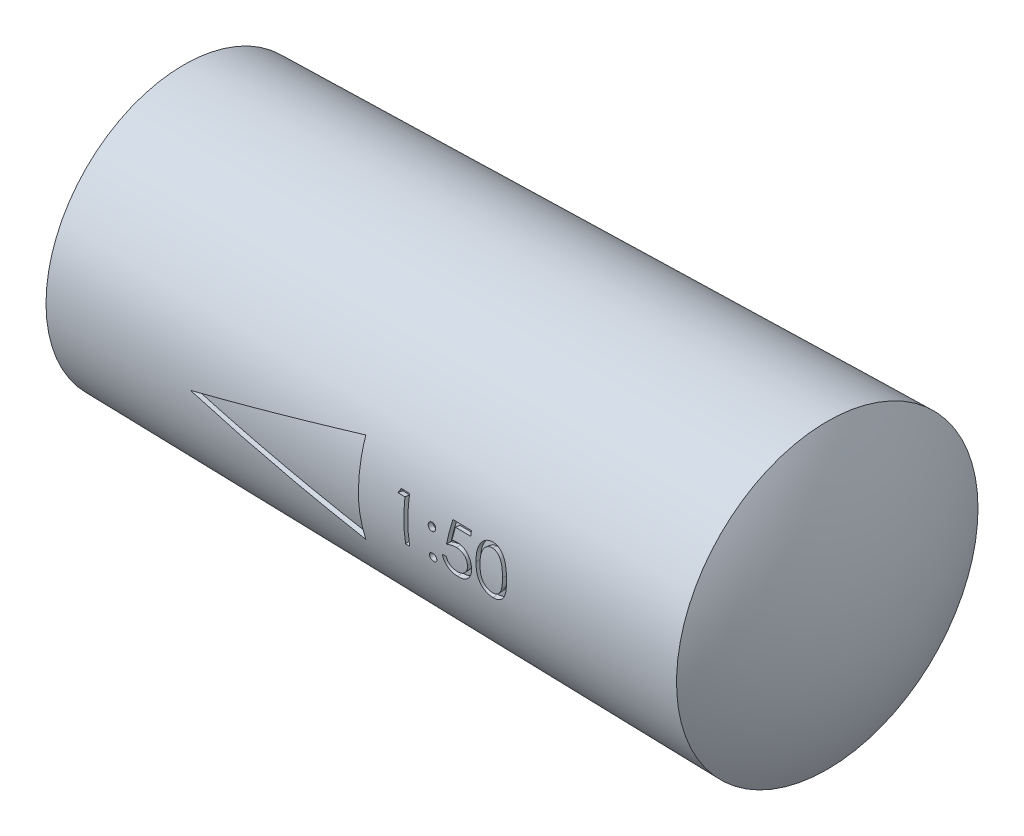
SolidWorks part; units mm, degrees
ref_plane "Front Plane" through (0, 0, 0) normal (0, 0, 1) x (1, 0, 0)
ref_plane "Top Plane" through (0, 0, 0) normal (0, 1, 0) x (1, 0, 0)
ref_plane "Right Plane" through (0, 0, 0) normal (1, 0, 0) x (0, 0, -1)
sketch "Sketch1" plane through (0, 0, 0) normal (1, 0, 0) x (0, 0, -1)
  circle A0 centre (0, 0) radius 3
  dimension "D1" = 6
extrude "Extrude1" add sketch "Sketch1" along normal mid plane 14
draft "Draft1" type of draft neutral plane draft angle 1.146 faces to draft 1 parameters "D1"=1.146
sketch "Sketch2" plane through (0, 0, 0) normal (0, 0, 1) x (1, 0, 0)
  line L0 (-7, 0) -> (-7, 3)
  line L1 (-7, 3) -> (-7, -3) construction
  line L2 (-7, 0) -> (-7.9, 0)
  line L3 (-7.9, 0) -> (-7.9, -3.14) construction
  line L4 (7, 0) -> (7, 3.28)
  line L5 (7, -3.28) -> (7, 3.28) construction
  line L6 (7, 0) -> (7.9, 0)
  line L7 (7.9, 0) -> (7.9, -3.14) construction
  line L8 (-7, -3) -> (7, -3.28) construction
  arc A0 (-7.9, 0) -> (-7, 3) centre (-2.45, 0) cw
  arc A1 (7.9, 0) -> (7, 3.28) centre (1.4731, 0) ccw
  point P14 (0, -3.14)
revolve "Revolve1" add sketch "Sketch2" angle 360 about L2
sketch "Sketch5" plane through (0, 0, 0) normal (0, 0, 1) x (1, 0, 0)
  line L0 (0, 3.14) -> (0, -3.14) construction
  line L1 (7, 3.28) -> (-7, 3) construction
  line L2 (-7, -3) -> (7, -3.28) construction
ref_plane "Plane2" through (0, 0, 0) normal (-0.02, 0, 0.9998) x (0.9998, 0, 0.02)
sketch "Sketch6" plane through (0, 0, 0) normal (-0.02, 0, 0.9998) x (0.9998, 0, 0.02)
  line L0 (0, 0) -> (0, 1)
  line L1 (0, 3.14) -> (0, -3.14) construction
  line L2 (0, 1) -> (-3.7321, 0)
  line L3 (-3.7321, 0) -> (0, -1)
  line L4 (0, -1) -> (0, 0)
  line L5 (0, -0.5) -> (4, -0.5) construction
  text T0 "1:50" font "Century Gothic" height 1
  dimension "D1" = 2
  dimension "D2" = 30
  dimension "D3" = 4
wrap "Wrap2" sketch "Sketch6" wrap type deboss source sketch "Sketch6" thickness 0.1 parameters "D1"=0.1
equation "\"D2@Sketch2\" = \"D1@Sketch2\""
